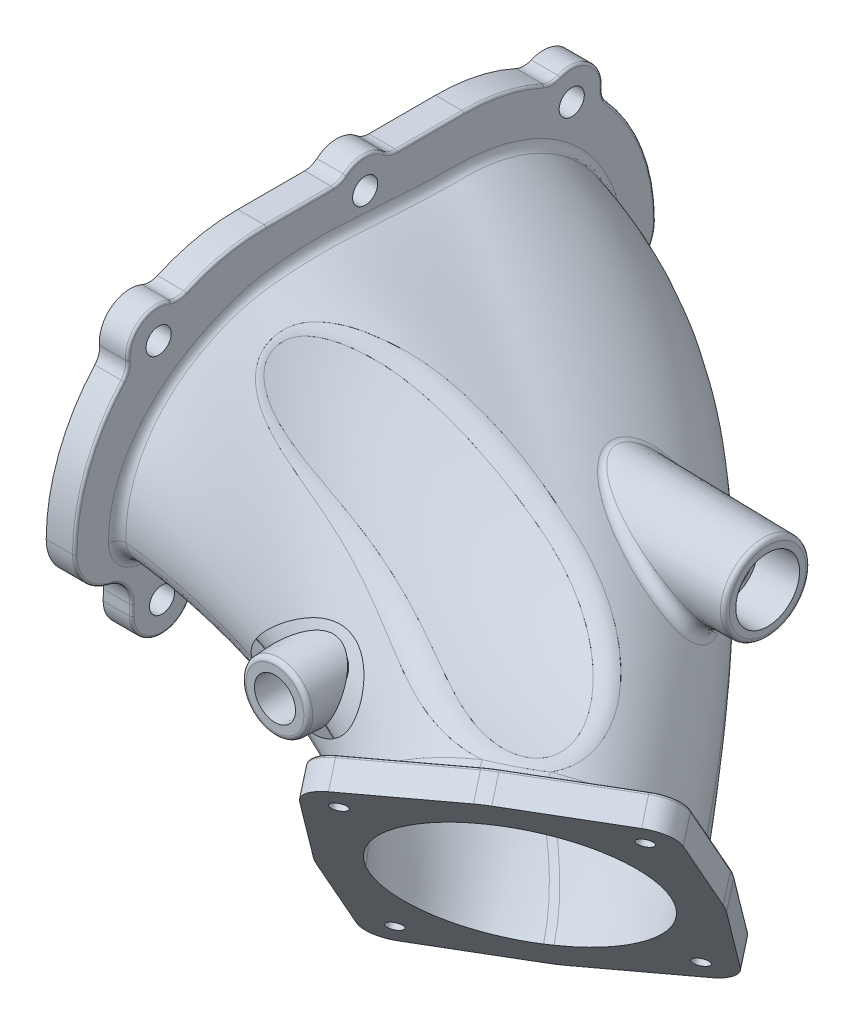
SolidWorks part; units mm, degrees
ref_plane "Front" through (0, 0, 0) normal (0, 0, 1) x (1, 0, 0)
ref_plane "Top" through (0, 0, 0) normal (0, 1, 0) x (1, 0, 0)
ref_plane "Right" through (0, 0, 0) normal (1, 0, 0) x (0, 0, -1)
imported_body "Surface-Imported1"
imported_body "Surface-Imported2"
surface "Surface-Fill4"
